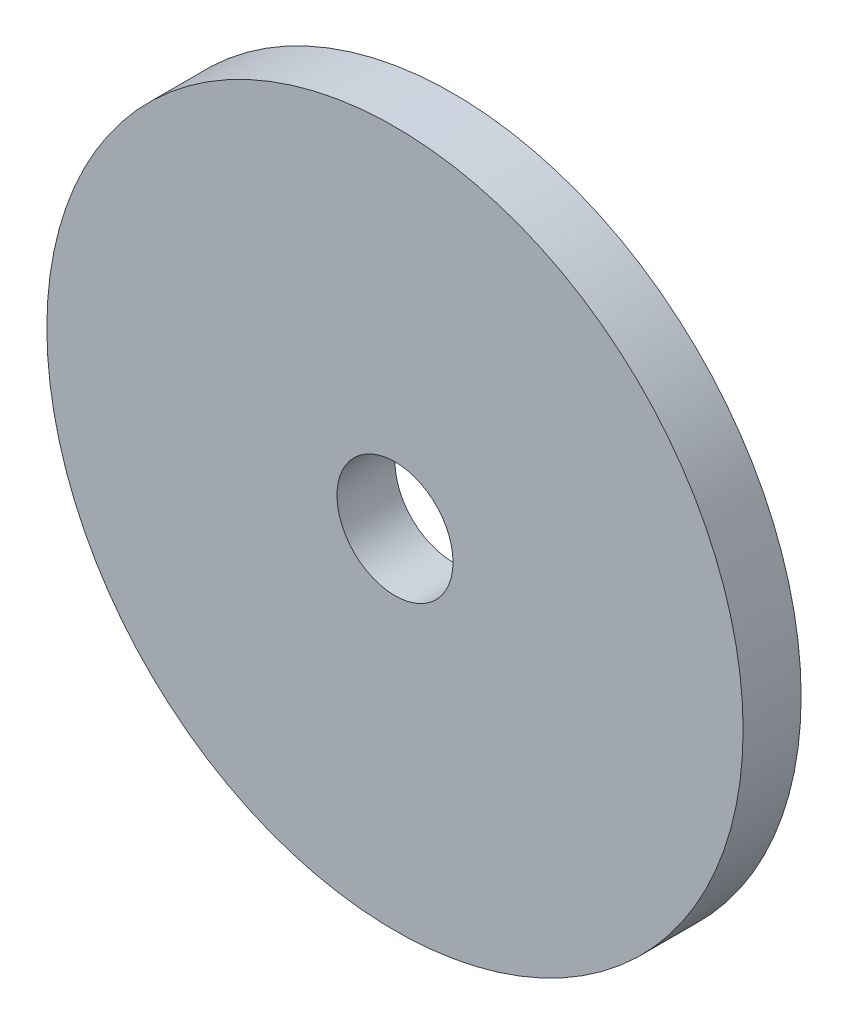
SolidWorks part; units mm, degrees
ref_plane "Front Plane" through (0, 0, 0) normal (0, 0, 1) x (1, 0, 0)
ref_plane "Top Plane" through (0, 0, 0) normal (0, 1, 0) x (1, 0, 0)
ref_plane "Right Plane" through (0, 0, 0) normal (1, 0, 0) x (0, 0, -1)
sketch "Sketch1" plane through (0, 0, 0) normal (0, 0, 1) x (1, 0, 0)
  circle A0 centre (0, 0) radius 19.05
  circle A1 centre (0, 0) radius 3.175
extrude "Boss-Extrude1" add sketch "Sketch1" along normal blind 3.175
